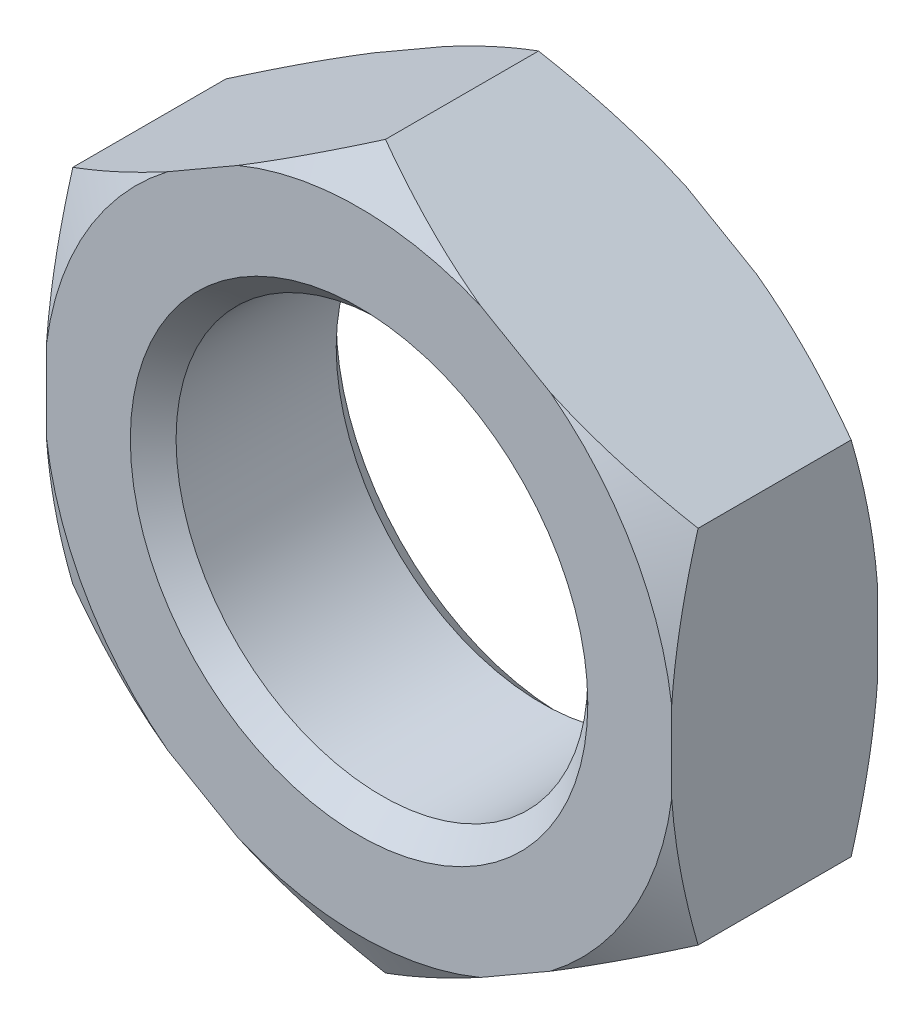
SolidWorks part; units mm, degrees
ref_plane "Front Plane" through (0, 0, 0) normal (0, 0, 1) x (1, 0, 0)
ref_plane "Top Plane" through (0, 0, 0) normal (0, 1, 0) x (1, 0, 0)
ref_plane "Right Plane" through (0, 0, 0) normal (1, 0, 0) x (0, 0, -1)
sketch "Sketch3" plane through (0, 0, 0) normal (0, 0, 1) x (1, 0, 0)
  line L1 (0, 23.6714) -> (-20.5, 11.8357)
  line L2 (-20.5, 11.8357) -> (-20.5, -11.8357)
  line L3 (-20.5, -11.8357) -> (0, -23.6714)
  line L4 (0, -23.6714) -> (20.5, -11.8357)
  line L5 (20.5, -11.8357) -> (20.5, 11.8357)
  line L6 (20.5, 11.8357) -> (0, 23.6714)
  circle A0 centre (0, 0) radius 20.5 construction
  dimension "D1" = 41
extrude "Boss-Extrude1" add sketch "Sketch3" along normal mid plane 13.5
sketch "Sketch4" plane through (0, 0, 0) normal (1, 0, 0) x (0, 0, -1)
  line L0 (-5.4578, 0) -> (6.1545, 0) construction
sketch "Sketch5" plane through (0, 0, 0) normal (1, 0, 0) x (0, 0, -1)
  line L0 (-6.75, 23.6714) -> (-6.75, 20.6714)
  line L1 (-6.75, 11.8357) -> (-6.75, 23.6714) construction
  line L2 (-6.75, 20.6714) -> (-5.0179, 23.6714)
  line L3 (-6.75, 23.6714) -> (6.75, 23.6714) construction
  line L4 (-5.0179, 23.6714) -> (-6.75, 23.6714)
  dimension "D1" = 3
  dimension "D2" = 30
revolve "Cut-Revolve1" cut sketch "Sketch5" angle 360 about L0
mirror "Mirror1" about plane through (0, 0, 0) normal (0, 0, 1) of "Cut-Revolve1"
sketch "Sketch6" plane through (0, 0, 6.75) normal (0, 0, 1) x (1, 0, 0)
  circle A0 centre (0, 0) radius 13.5
  dimension "D1" = 27
extrude "Cut-Extrude1" cut sketch "Sketch6" against normal blind 13.5
chamfer "Chamfer1" distance 1.5 angle 45 2 edges at (13.5, 0, -6.75) (13.5, 0, 6.75)
